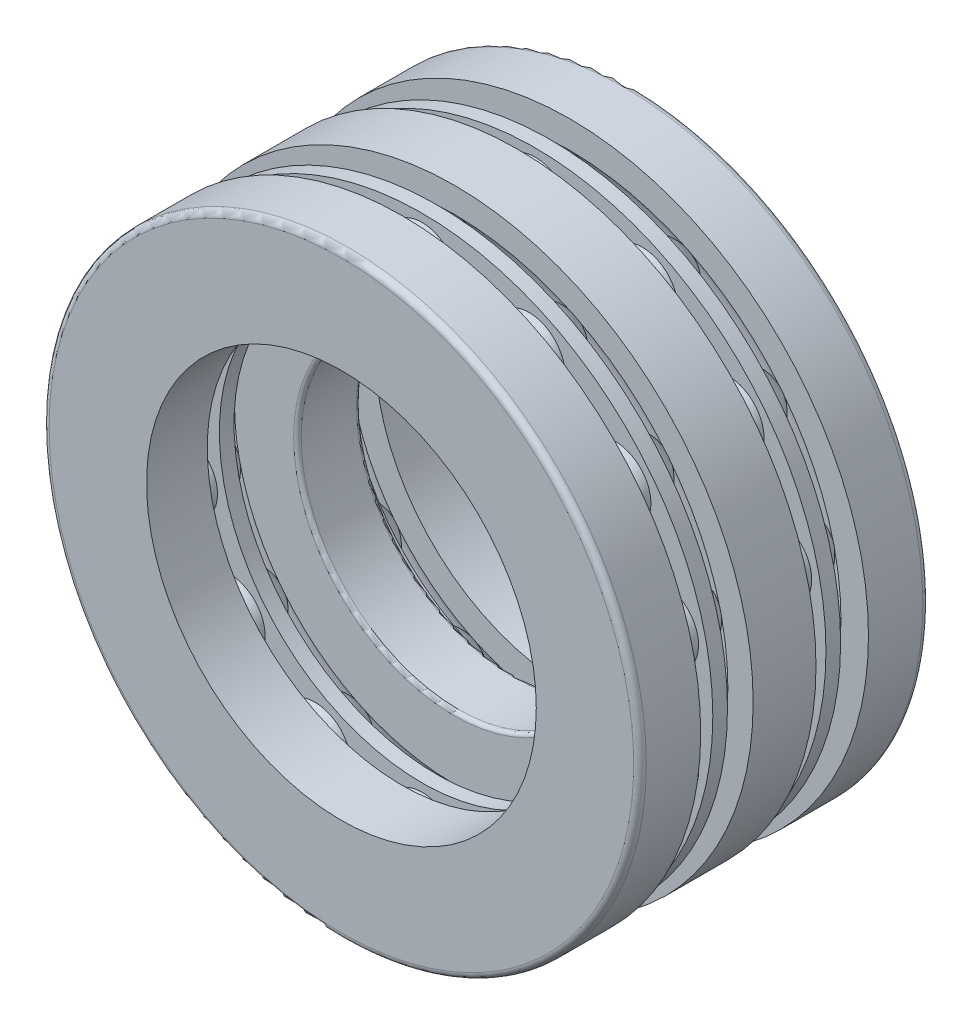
SolidWorks part; units mm, degrees
ref_plane "Front Plane" through (0, 0, 0) normal (0, 0, 1) x (1, 0, 0)
ref_plane "Top Plane" through (0, 0, 0) normal (0, 1, 0) x (1, 0, 0)
ref_plane "Right Plane" through (0, 0, 0) normal (1, 0, 0) x (0, 0, -1)
sketch "BaseSke" plane through (0, 0, 0) normal (1, 0, 0) x (0, 0, -1)
  line L0 (-14, 0) -> (32, 0) construction
  line L1 (-14, 39.25) -> (32, 39.25) construction
  line L2 (0, 129.5214) -> (0, -86.3012) construction
  line L3 (0, 45.0833) -> (0, 33.4167)
  line L6 (-14, 47.5) -> (-14, 31) construction
  line L8 (14, 47.5) -> (14, 25) construction
  arc A0 (0, 45.0833) -> (0, 33.4167) centre (0, 39.25) ccw
  point P10 (9, 0)
  dimension "D2" = 14
  dimension "Ball_diameter" = 11.6667
  dimension "D1" = 39.25
  dimension "Bearing_Thickness" = 46
  dimension "Diameter2" = 95
  dimension "Bearing_Inside_Diameter" = 50
  dimension "Thickness2" = 28
  dimension "Diameter1" = 62
  dimension "Bearing_Outside_Diameter" = 95
revolve "Ball" add sketch "BaseSke" angle 360 about L3
sketch "InnerRaceSke" plane through (0, 0, 0) normal (1, 0, 0) x (0, 0, -1)
  line L0 (4, 35.0178) -> (4, 25)
  line L1 (4, 47.5) -> (14, 47.5)
  line L2 (4, 47.5) -> (4, 43.4822)
  line L3 (4, 25) -> (14, 25)
  line L4 (14, 47.5) -> (14, 25)
  line L5 (-18.959, 0) -> (19.5136, 0) construction
  line L6 (9, 0) -> (9, 15.6734) construction
  arc A0 (4, 35.0178) -> (4, 43.4822) centre (0, 39.25) ccw
  arc A2 (0, 45.0833) -> (0, 33.4167) centre (0, 39.25) ccw construction
  dimension "D1" = 11.6467
  dimension "Middle_thickness" = 10
revolve "InnerRace" add sketch "InnerRaceSke" angle 360 about L5
sketch "OuterRaceSke" plane through (0, 0, 0) normal (1, 0, 0) x (0, 0, -1)
  line L0 (-4.3448, 35.3727) -> (-4.3448, 31)
  line L1 (-14, 47.5) -> (-4.3448, 47.5)
  line L2 (-14, 47.5) -> (-14, 31)
  line L3 (-14, 31) -> (-4.3448, 31)
  line L4 (-4.3448, 47.5) -> (-4.3448, 43.1273)
  line L5 (-27.1643, 0) -> (37.3715, 0) construction
  arc A0 (-4.3448, 43.1273) -> (-4.3448, 35.3727) centre (0, 39.25) ccw
  arc A1 (0, 45.0833) -> (0, 33.4167) centre (0, 39.25) ccw construction
  dimension "D1" = 11.6467
  dimension "D2" = 9.6552
revolve "OuterRace" add sketch "OuterRaceSke" angle 360 about L5
fillet "Fillet1" radius 1 1 edges at (47.5, 0, 14)
fillet "Fillet2" radius 0.6 2 edges at (25, 0, -14) (25, 0, -4)
pattern_circular "CirPatternBall" count 14 over 360 about axis through (0, 0, 0) along (0, 0, 1) of "Ball"
sketch "CageSke" plane through (0, 0, 0) normal (1, 0, 0) x (0, 0, -1)
  line L0 (0, 59.1614) -> (0, 0) construction
  line L1 (1.1667, 46.25) -> (-1.1667, 46.25)
  line L2 (1.1667, 46.25) -> (1.1667, 32.25)
  line L3 (1.1667, 32.25) -> (-1.1667, 32.25)
  line L4 (-1.1667, 46.25) -> (-1.1667, 32.25)
  line L5 (-23.077, 0) -> (28.998, 0) construction
  circle A0 centre (0, 39.25) radius 7.0966 construction
  arc A1 (0, 45.0833) -> (0, 33.4167) centre (0, 39.25) ccw construction
  dimension "D1" = 2.3333
  dimension "D2" = 14
revolve "Cage" add sketch "CageSke" angle 360 about L5
sketch "SimplifiedSke" plane through (0, 0, 0) normal (1, 0, 0) x (0, 0, -1)
  line L0 (-32.3536, 0) -> (41.9236, 0) construction
  circle A0 centre (0, 39.25) radius 5.8333
  arc A1 (0, 45.0833) -> (0, 33.4167) centre (0, 39.25) ccw construction
revolve "Simplified" [suppressed] add sketch "SimplifiedSke" angle 360 about L0
ref_plane "Plane" through (0, 0, -9) normal (0, 0, 1) x (1, 0, 0)
other "SurfaceCut"
mirror "MirrorBody" about plane through (0, 0, -9) normal (0, 0, 1)
equation "\"D2@BaseSke\" = \"Thickness2@BaseSke\"/2"
equation "\"D1@BaseSke\" =  ( \"Diameter1@BaseSke\" +\"Bearing_Outside_Diameter@BaseSke\" )  / 4"
equation "\"Ball_diameter@BaseSke\" = \"Thickness2@BaseSke\"  / 2.4"
equation "\"D1@InnerRaceSke\" = \"Ball_diameter@BaseSke\"-0.02"
equation "\"D1@OuterRaceSke\" = \"Ball_diameter@BaseSke\"-0.02"
equation "\"D2@OuterRaceSke\" = \"Thickness2@BaseSke\" / 2.9"
equation "\"D1@CirPatternBall\" =  pi  * \"D1@BaseSke\" * 2 / \"Ball_diameter@BaseSke\"/1.5"
equation "\"D1@CageSke\" = \"Ball_diameter@BaseSke\"/5"
equation "\"D2@CageSke\" = \"Ball_diameter@BaseSke\" * 1.2"
equation "\"D1@Plane\" = \"Bearing_Thickness@BaseSke\"/2"
